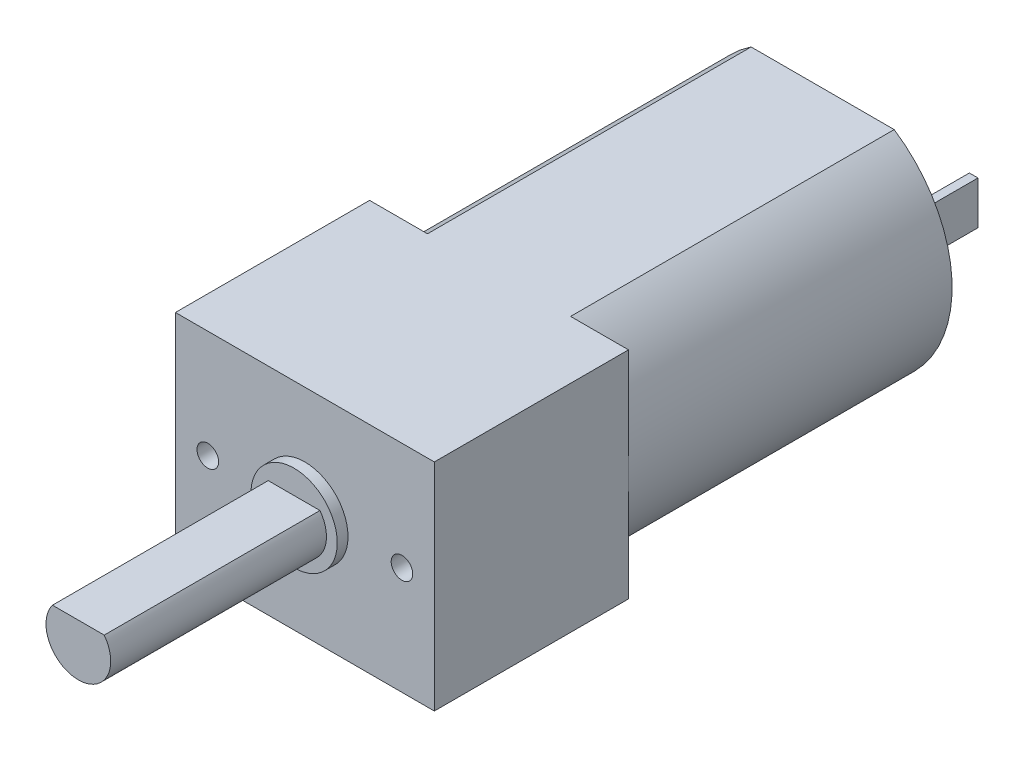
SolidWorks part; units mm, degrees
ref_plane "Ebene vorne" through (0, 0, 0) normal (0, 0, 1) x (1, 0, 0)
ref_plane "Ebene oben" through (0, 0, 0) normal (0, 1, 0) x (1, 0, 0)
ref_plane "Ebene rechts" through (0, 0, 0) normal (1, 0, 0) x (0, 0, -1)
sketch "Skizze1" plane through (0, 0, 0) normal (0, 0, 1) x (1, 0, 0)
  line L1 (6, 5) -> (-6, 5)
  line L2 (6, 5) -> (6, -5)
  line L3 (6, -5) -> (-6, -5)
  line L4 (-6, 5) -> (-6, -5)
  line L5 (6, 5) -> (-6, -5) construction
  line L6 (6, -5) -> (-6, 5) construction
  circle A0 centre (-4.5, 0) radius 0.5
  circle A1 centre (4.5, 0) radius 0.5
  point P0 (0, 0)
  dimension "D3" = 4.5
  dimension "D4" = 4.5
  dimension "D5" = 1
  dimension "D6" = 1
  dimension "D1" = 10
  dimension "D2" = 12
extrude "Aufsatz-Linear austragen1" add sketch "Skizze1" along normal blind 9
sketch "Skizze2" plane through (0, 0, 9) normal (0, 0, 1) x (1, 0, 0)
  circle A0 centre (0, 0) radius 2
  dimension "D1" = 4
extrude "Aufsatz-Linear austragen2" add sketch "Skizze2" along normal blind 0.5
sketch "Skizze3" plane through (0, 0, 9.5) normal (0, 0, 1) x (1, 0, 0)
  line L0 (-1.2, 0.9) -> (1.2, 0.9)
  arc A0 (-1.2, 0.9) -> (1.2, 0.9) centre (0, 0) ccw
  dimension "D1" = 3
  dimension "D2" = 2.4
extrude "Aufsatz-Linear austragen3" add sketch "Skizze3" along normal blind 10 separate body
sketch "Skizze4" plane through (0, 0, 0) normal (0, 0, -1) x (-1, 0, 0)
  line L0 (-3.3166, 5) -> (3.3166, 5)
  line L1 (-6, 5) -> (6, 5) construction
  line L2 (-3.3166, -5) -> (3.3166, -5)
  arc A0 (-3.3166, 5) -> (-3.3166, -5) centre (0, 0) ccw
  arc A1 (3.3166, -5) -> (3.3166, 5) centre (0, 0) ccw
extrude "Aufsatz-Linear austragen4" add sketch "Skizze4" along normal blind 15
sketch "Skizze5" plane through (0, 0, -15) normal (0, 0, -1) x (-1, 0, 0)
  line L0 (0, 5.5) -> (0, -5.5) construction
  line L1 (-3.2, 1) -> (-2.8, 1)
  line L2 (-3.2, 1) -> (-3.2, -1)
  line L3 (-3.2, -1) -> (-2.8, -1)
  line L4 (-2.8, 1) -> (-2.8, -1)
  line L5 (3.2, 1) -> (2.8, 1)
  line L6 (2.8, 1) -> (2.8, -1)
  line L7 (3.2, -1) -> (2.8, -1)
  line L8 (3.2, 1) -> (3.2, -1)
  dimension "D1" = 0.4
  dimension "D2" = 2
  dimension "D3" = 1
  dimension "D4" = 2.8
extrude "Aufsatz-Linear austragen5" add sketch "Skizze5" along normal blind 4
